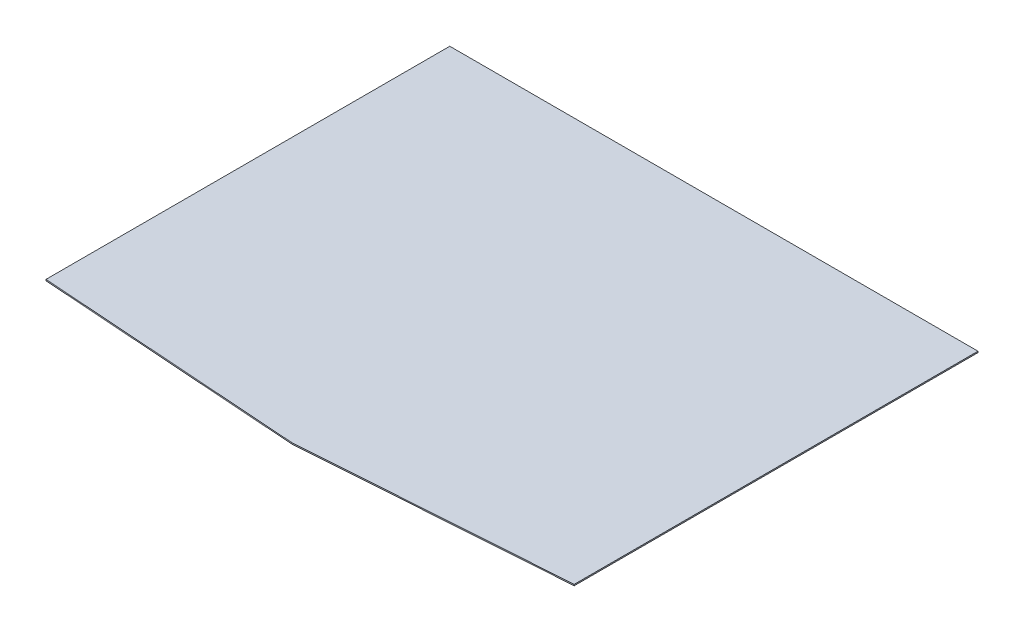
SolidWorks part; units mm, degrees
ref_plane "Front Plane" through (0, 0, 0) normal (0, 0, 1) x (1, 0, 0)
ref_plane "Top Plane" through (0, 0, 0) normal (0, 1, 0) x (1, 0, 0)
ref_plane "Right Plane" through (0, 0, 0) normal (1, 0, 0) x (0, 0, -1)
sketch "Sketch1" plane through (0, 0, 0) normal (0, 1, 0) x (1, 0, 0)
  line L0 (-996.95, 1593.85) -> (-996.95, 69.7135)
  line L1 (-996.95, 69.7135) -> (0, 0)
  line L2 (0, 0) -> (996.95, 69.7135)
  line L3 (996.95, 69.7135) -> (996.95, 1593.85)
  line L4 (996.95, 1593.85) -> (-996.95, 1593.85)
  line L5 (-90.22, 0) -> (124.4313, 0) construction
  dimension "D1" = 4
  dimension "D2" = 4
  dimension "D3" = 1993.9
  dimension "D4" = 1593.85
  dimension "D5" = 996.95
  dimension "D6" = 996.95
sheet metal parameters "Sheet-Metal1" thickness 4.7625 parameters "D1"=4.7625
base flange "Base-Flange1" sketch "Sketch1" thickness 4.7625 reverse thickness direction no parameters "D1"=4.7625
flat pattern "Flat-Pattern1"
sketch "Bend-Lines1" plane through (0, 0, 0) normal (0, 1, 0) x (-1, 0, 0)
sketch3d "Bounding-Box1" [suppressed]
  line L0 (0, -69.7135, 0) -> (-1993.9, -69.7135, 0) construction
  line L1 (0, -1663.5635, 0) -> (-1993.9, -1663.5635, 0) construction
  line L2 (0, -69.7135, 0) -> (0, -1663.5635, 0) construction
  line L3 (-1993.9, -69.7135, 0) -> (-1993.9, -1663.5635, 0) construction
